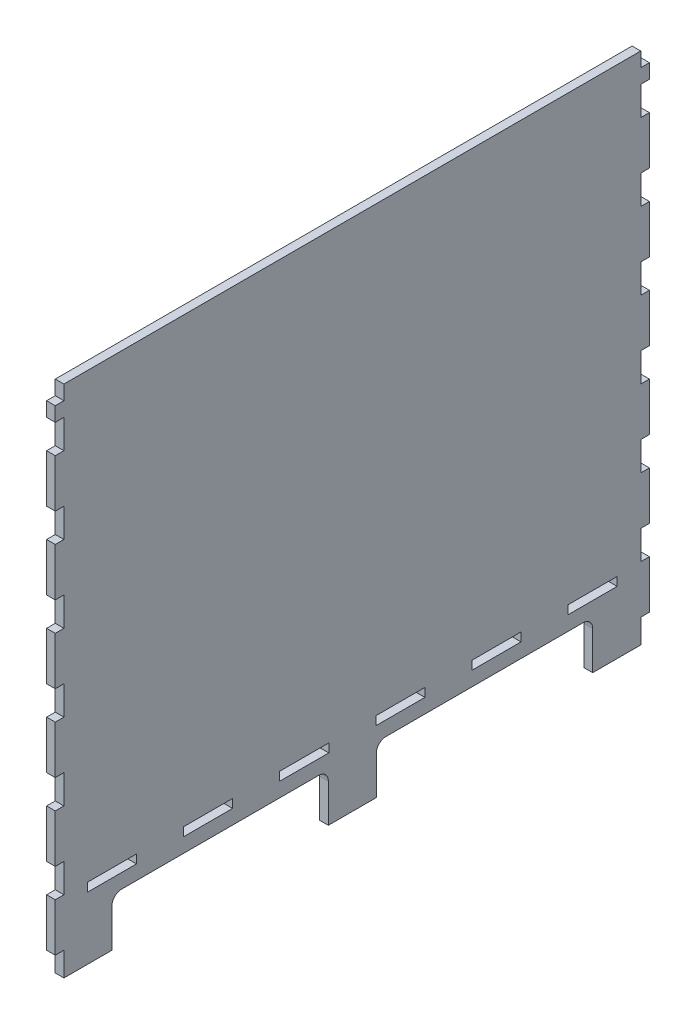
SolidWorks part; units mm, degrees
ref_plane "Front Plane" through (0, 0, 0) normal (0, 0, 1) x (1, 0, 0)
ref_plane "Top Plane" through (0, 0, 0) normal (0, 1, 0) x (1, 0, 0)
ref_plane "Right Plane" through (0, 0, 0) normal (1, 0, 0) x (0, 0, -1)
sketch "Sketch1" plane through (0, 0, 0) normal (1, 0, 0) x (0, 0, -1)
  line L0 (-300, -264.3326) -> (-300, -289.3326)
  line L1 (-300, 245.6674) -> (300, 245.6674)
  line L2 (-300, 245.6674) -> (-300, 230.6674)
  line L3 (-240, -239.3326) -> (-35, -239.3326)
  line L4 (300, 245.6674) -> (300, 230.6674)
  line L5 (-300, -289.3326) -> (-250, -289.3326)
  line L6 (-250, -289.3326) -> (-250, -249.3326)
  line L7 (300, -264.3326) -> (309, -264.3326)
  line L8 (-25, -249.3326) -> (-25, -289.3326)
  line L9 (25, -289.3326) -> (25, -249.3326)
  line L10 (-25, -289.3326) -> (25, -289.3326)
  line L11 (250, -249.3326) -> (250, -289.3326)
  line L12 (309, -264.3326) -> (309, -214.3326)
  line L13 (250, -289.3326) -> (300, -289.3326)
  line L14 (35, -239.3326) -> (240, -239.3326)
  line L15 (-300, -264.3326) -> (-309, -264.3326)
  line L16 (-309, -264.3326) -> (-309, -214.3326)
  line L17 (-309, -214.3326) -> (-300, -214.3326)
  line L18 (-309, -184.3326) -> (-309, -134.3326)
  line L19 (-309, -134.3326) -> (-300, -134.3326)
  line L20 (-300, -184.3326) -> (-309, -184.3326)
  line L21 (-309, -104.3326) -> (-309, -54.3326)
  line L22 (-309, -54.3326) -> (-300, -54.3326)
  line L23 (-300, -104.3326) -> (-309, -104.3326)
  line L24 (309, -214.3326) -> (300, -214.3326)
  line L25 (309, -134.3326) -> (300, -134.3326)
  line L26 (300, -289.3326) -> (300, -214.3326)
  line L27 (309, -184.3326) -> (309, -134.3326)
  line L28 (300, -184.3326) -> (309, -184.3326)
  line L29 (309, -54.3326) -> (300, -54.3326)
  line L30 (309, -104.3326) -> (309, -54.3326)
  line L31 (300, -104.3326) -> (309, -104.3326)
  line L32 (300, -264.3326) -> (300, -289.3326)
  line L33 (300, -184.3326) -> (300, -214.3326)
  line L34 (300, -104.3326) -> (300, -134.3326)
  line L35 (-300, -184.3326) -> (-300, -214.3326)
  line L36 (-300, -104.3326) -> (-300, -134.3326)
  line L37 (-309, 25.6674) -> (-300, 25.6674)
  line L38 (-309, -24.3326) -> (-309, 25.6674)
  line L39 (-300, -24.3326) -> (-309, -24.3326)
  line L40 (-309, 105.6674) -> (-300, 105.6674)
  line L41 (-309, 55.6674) -> (-309, 105.6674)
  line L42 (-300, 55.6674) -> (-309, 55.6674)
  line L43 (-309, 185.6674) -> (-300, 185.6674)
  line L44 (-309, 135.6674) -> (-309, 185.6674)
  line L45 (-300, 135.6674) -> (-309, 135.6674)
  line L46 (-300, -24.3326) -> (-300, -54.3326)
  line L47 (-300, 55.6674) -> (-300, 25.6674)
  line L48 (-300, 135.6674) -> (-300, 105.6674)
  line L49 (309, 25.6674) -> (300, 25.6674)
  line L50 (309, -24.3326) -> (309, 25.6674)
  line L51 (300, -24.3326) -> (309, -24.3326)
  line L52 (309, 105.6674) -> (300, 105.6674)
  line L53 (309, 55.6674) -> (309, 105.6674)
  line L54 (300, 55.6674) -> (309, 55.6674)
  line L55 (309, 185.6674) -> (300, 185.6674)
  line L56 (309, 135.6674) -> (309, 185.6674)
  line L57 (300, 135.6674) -> (309, 135.6674)
  line L58 (300, 135.6674) -> (300, 105.6674)
  line L59 (300, 55.6674) -> (300, 25.6674)
  line L60 (300, -24.3326) -> (300, -54.3326)
  line L61 (300, 215.6674) -> (309, 215.6674)
  line L62 (309, 215.6674) -> (309, 230.6674)
  line L63 (309, 230.6674) -> (300, 230.6674)
  line L64 (-300, 215.6674) -> (-309, 215.6674)
  line L65 (-309, 215.6674) -> (-309, 230.6674)
  line L66 (-309, 230.6674) -> (-300, 230.6674)
  line L67 (-300, 215.6674) -> (-300, 185.6674)
  line L68 (300, 215.6674) -> (300, 185.6674)
  arc A0 (-35, -239.3326) -> (-25, -249.3326) centre (-35, -249.3326) cw
  arc A1 (-240, -239.3326) -> (-250, -249.3326) centre (-240, -249.3326) ccw
  arc A2 (25, -249.3326) -> (35, -239.3326) centre (35, -249.3326) cw
  arc A3 (240, -239.3326) -> (250, -249.3326) centre (240, -249.3326) cw
  dimension "D2" = 10
  dimension "D3" = 10
  dimension "D5" = 10
  dimension "D7" = 10
  dimension "D4" = 50
  dimension "D8" = 9
  dimension "D9" = 50
  dimension "D10" = 25
  dimension "D11" = 535
  dimension "D12" = 600
  dimension "D13" = 50
  dimension "D15" = 25
  dimension "D16" = 50
  dimension "D17" = 9
  dimension "D21" = 30
  dimension "D22" = 15
  dimension "D23" = 30
  dimension "D24" = 15
  dimension "D6" = 3
  dimension "D14" = 3
  dimension "D18" = 3
  dimension "D19" = 4
  dimension "D20" = 4
extrude "Boss-Extrude1" add sketch "Sketch1" along normal blind 9
sketch "Sketch2" plane through (9, 0, 0) normal (1, 0, 0) x (0, 0, -1)
  line L0 (-240, -239.3326) -> (-35, -239.3326) construction
  line L1 (-275.5, -215.3326) -> (-224.5, -215.3326)
  line L2 (-275.5, -215.3326) -> (-275.5, -224.3326)
  line L3 (-275.5, -224.3326) -> (-224.5, -224.3326)
  line L4 (-224.5, -215.3326) -> (-224.5, -224.3326)
  dimension "D1" = 51
  dimension "D2" = 9
  dimension "D3" = 15
  dimension "D4" = 24.5
extrude "Cut-Extrude1" cut sketch "Sketch2" against normal through all
pattern_linear "LPattern1" count 6 spacing 100 along (0, 0, -1) of "Cut-Extrude1"
